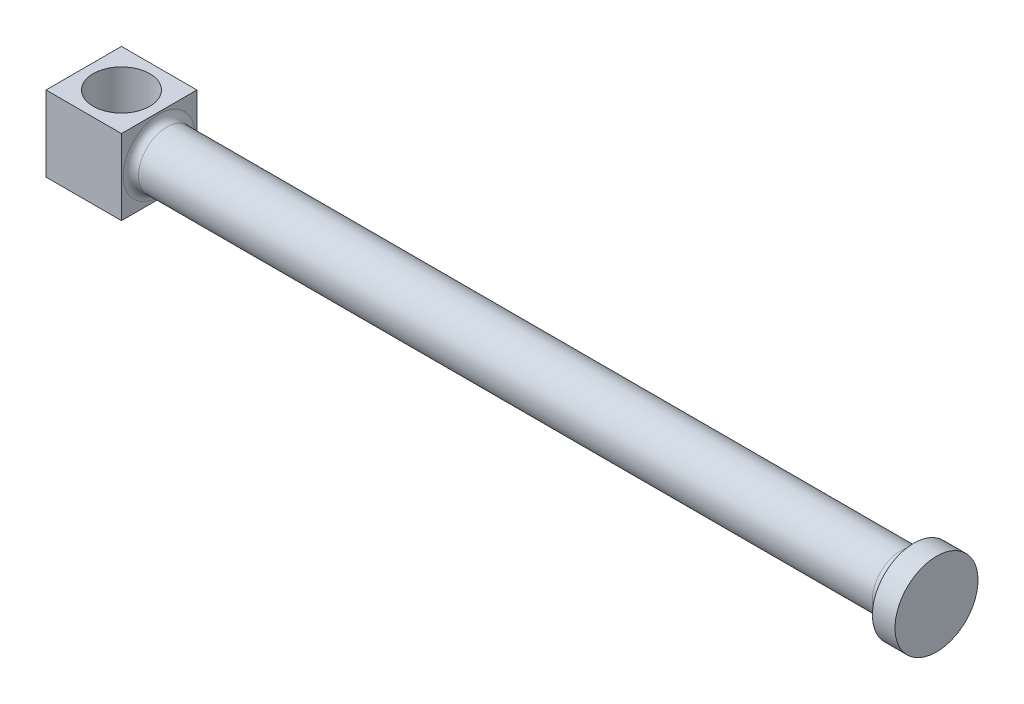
SolidWorks part; units mm, degrees
ref_plane "Front View" through (0, 0, 0) normal (0, 0, 1) x (1, 0, 0)
ref_plane "Upper View" through (0, 0, 0) normal (0, 1, 0) x (1, 0, 0)
ref_plane "Right View" through (0, 0, 0) normal (1, 0, 0) x (0, 0, -1)
sketch "Sketch1" plane through (0, 0, 0) normal (1, 0, 0) x (0, 0, -1)
  line L0 (-24.4866, 21.9091) -> (175.5134, 21.9091)
  line L1 (175.5134, 21.9091) -> (175.5134, -178.0909)
  line L2 (175.5134, -178.0909) -> (-24.4866, -178.0909)
  line L3 (-24.4866, -178.0909) -> (-24.4866, 21.9091)
extrude "Boss-Extrude1" add sketch "Sketch1" along normal blind 200
sketch "Sketch2" plane through (0, 21.9091, 0) normal (0, 1, 0) x (1, 0, 0)
  circle A0 centre (100, 75.5134) radius 75
extrude "Cut-Extrude1" cut sketch "Sketch2" against normal blind 200
sketch "Sketch3" plane through (200, 0, 0) normal (1, 0, 0) x (0, 0, -1)
  circle A0 centre (75.5134, -78.0909) radius 75
extrude "Boss-Extrude2" add sketch "Sketch3" along normal blind 2000
sketch "Sketch4" plane through (2200, 0, 0) normal (1, 0, 0) x (0, 0, -1)
  circle A0 centre (75.5134, -78.0909) radius 110
extrude "Boss-Extrude3" add sketch "Sketch4" along normal blind 60
fillet "Fillet6" radius 20 1 edges at (200, -78.0909, -150.5134)
fillet "Fillet8" radius 35 1 edges at (2200, -78.0909, -150.5134)
